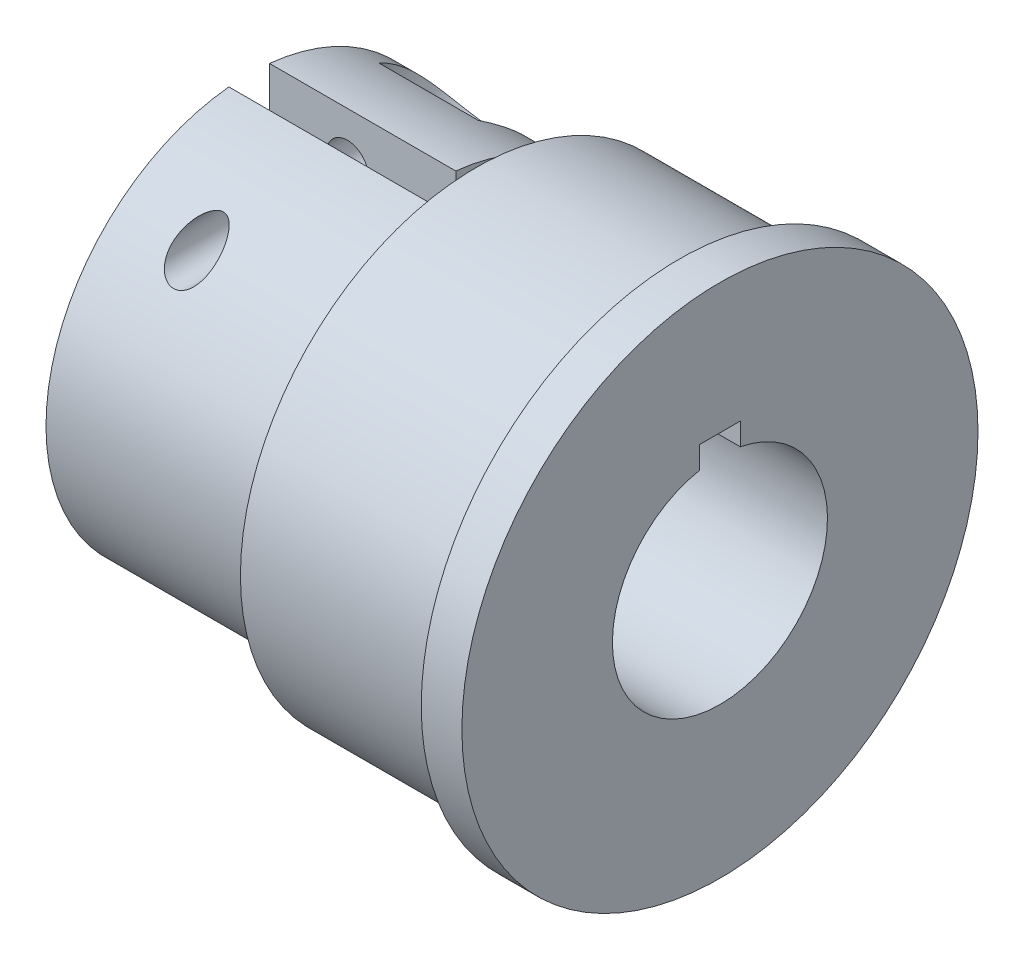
SolidWorks part; units mm, degrees
ref_plane "Front Plane" through (0, 0, 0) normal (0, 0, 1) x (1, 0, 0)
ref_plane "Top Plane" through (0, 0, 0) normal (0, 1, 0) x (1, 0, 0)
ref_plane "Right Plane" through (0, 0, 0) normal (1, 0, 0) x (0, 0, -1)
sketch "Sketch1" plane through (0, 0, 0) normal (0, 0, 1) x (1, 0, 0)
  line L0 (0, 0) -> (23.6589, 0) construction
  line L1 (0, 17.399) -> (0, 0)
  line L2 (0, 0) -> (18, 0)
  line L4 (18, 17.399) -> (15, 17.399)
  line L5 (0, 7.9375) -> (18, 7.9375)
  line L6 (18, 17.399) -> (18, 19.05)
  line L7 (0, 17.399) -> (18, 17.399)
  line L8 (18, 0) -> (18, 17.399)
  line L9 (18, 19.05) -> (15, 19.05)
  line L10 (15, 17.399) -> (15, 19.05)
  dimension "D1" = 17.399
  dimension "D2" = 3
  dimension "D3" = 19.05
  dimension "D4" = 18
  dimension "D5" = 7.9375
revolve "Revolve1" add sketch "Sketch1" angle 360 about L0
sketch "Sketch2" plane through (18, 0, 0) normal (1, 0, 0) x (0, 0, -1)
  line L1 (-1.5, 6.4375) -> (1.5, 6.4375)
  line L2 (-1.5, 6.4375) -> (-1.5, 9.4375)
  line L3 (-1.5, 9.4375) -> (1.5, 9.4375)
  line L4 (1.5, 6.4375) -> (1.5, 9.4375)
  line L5 (-1.5, 6.4375) -> (1.5, 9.4375) construction
  line L6 (-1.5, 9.4375) -> (1.5, 6.4375) construction
  circle A0 centre (0, 0) radius 7.9375 construction
  point P0 (0, 7.9375)
  dimension "D1" = 3
  dimension "D2" = 3
extrude "Cut-Extrude1" cut sketch "Sketch2" against normal through all
sketch "Sketch6" plane through (0, 0, 0) normal (-1, 0, 0) x (0, 0, 1)
  line L0 (-1.5, 9.4375) -> (1.5, 9.4375) construction
  line L1 (-1.5, 16.0695) -> (1.5, 16.0695)
  line L2 (-1.5, 16.0695) -> (-1.5, 6.8533)
  line L3 (-1.5, 6.8533) -> (1.5, 6.8533)
  line L4 (1.5, 16.0695) -> (1.5, 6.8533)
  line L5 (-1.5, 16.0695) -> (1.5, 6.8533) construction
  line L6 (-1.5, 6.8533) -> (1.5, 16.0695) construction
  circle A0 centre (0, 0) radius 7.9375
  circle A1 centre (0, 0) radius 15
  point P4 (0, 11.4614)
  point P11 (0, 9.4375)
  dimension "D1" = 3
extrude "Boss-Extrude2" add sketch "Sketch6" along normal blind 30 contours L2 A1 L4 M4 M1 M2
sketch "Sketch7" plane through (0, 0, 0) normal (0, 0, 1) x (1, 0, 0)
  line L1 (-3, -16.9676) -> (0, -16.9676)
  line L2 (-3, -16.9676) -> (-3, 16.9676)
  line L3 (-3, 16.9676) -> (0, 16.9676)
  line L4 (0, -16.9676) -> (0, 16.9676)
  line L5 (-3, -16.9676) -> (0, 16.9676) construction
  line L6 (-3, 16.9676) -> (0, -16.9676) construction
  point P0 (-1.5, 0)
  dimension "D1" = 3
extrude "Cut-Extrude3" cut sketch "Sketch7" against normal blind 30
sketch "Sketch8" plane through (0, 0, -1.5) normal (0, 0, 1) x (1, 0, 0)
  line L0 (-30, 11.3596) -> (-3, 11.3596) construction
  line L1 (-30, 14.9248) -> (-30, 7.7945) construction
  line L2 (-3, 7.7945) -> (-3, 14.9248) construction
  circle A0 centre (-22, 11.3596) radius 1.5335
  circle A1 centre (-11, 11.3596) radius 1.5335
  dimension "D1" = 8
  dimension "D2" = 8
extrude "Cut-Extrude4" cut sketch "Sketch8" against normal through all both and the other way through all
ref_plane "Plane1" through (0, 0, -11.5) normal (0, 0, -1) x (-1, 0, 0)
sketch "Sketch9" plane through (0, 0, -11.5) normal (0, 0, -1) x (-1, 0, 0)
  circle A0 centre (11, 11.3596) radius 4
  circle A1 centre (22, 11.3596) radius 4
extrude "Cut-Extrude5" cut sketch "Sketch9" against normal blind 4 and the other way through all
sketch "Sketch10" plane through (0, 0, 0) normal (0, 0, 1) x (1, 0, 0)
  line L1 (-16.7523, 15.4563) -> (-32.162, 15.4563)
  line L2 (-16.7523, 15.4563) -> (-16.7523, -17.2789)
  line L3 (-16.7523, -17.2789) -> (-32.162, -17.2789)
  line L4 (-32.162, 15.4563) -> (-32.162, -17.2789)
extrude "Cut-Extrude6" cut sketch "Sketch10" against normal through all both and the other way through all
